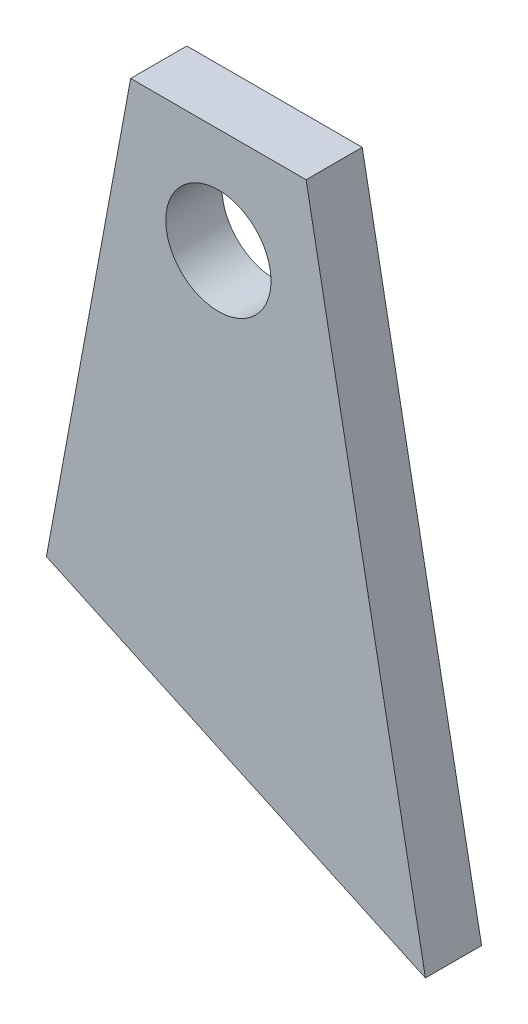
SolidWorks part; units mm, degrees
ref_plane "前视基准面" through (0, 0, 0) normal (0, 0, 1) x (1, 0, 0)
ref_plane "上视基准面" through (0, 0, 0) normal (0, 1, 0) x (1, 0, 0)
ref_plane "右视基准面" through (0, 0, 0) normal (1, 0, 0) x (0, 0, -1)
sketch "草图1" plane through (0, 0, 0) normal (0, 0, 1) x (1, 0, 0)
  line L0 (0, 80.3696) -> (0, -88.3645) construction
  line L1 (-25, 0) -> (25, 0)
  line L2 (25, 0) -> (59, -180)
  line L3 (59, -180) -> (-49, -130)
  line L4 (-49, -130) -> (-25, 0)
  circle A0 centre (0, -30) radius 15
  dimension "D7" = 30
  dimension "D8" = 30
  dimension "D1" = 50
  dimension "D2" = 25
  dimension "D3" = 34
  dimension "D4" = 180
  dimension "D5" = 130
  dimension "D6" = 24
extrude "拉伸1" add sketch "草图1" along normal blind 16
